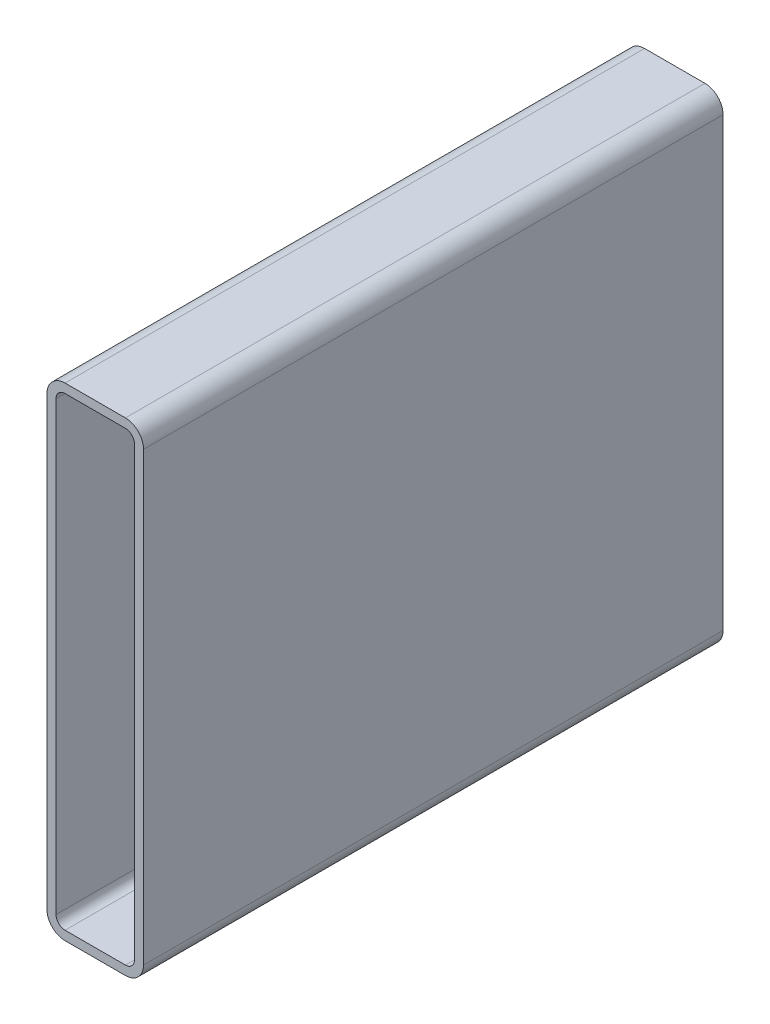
SolidWorks part; units mm, degrees
ref_plane "Front Plane" through (0, 0, 0) normal (0, 0, 1) x (1, 0, 0)
ref_plane "Top Plane" through (0, 0, 0) normal (0, 1, 0) x (1, 0, 0)
ref_plane "Right Plane" through (0, 0, 0) normal (1, 0, 0) x (0, 0, -1)
sketch "Sketch1" plane through (0, 0, 0) normal (0, 0, 1) x (1, 0, 0)
  line B0 (9.525, 254) -> (41.275, 254)
  arc B1 (50.8, 244.475) -> (41.275, 254) centre (41.275, 244.475) ccw
  line B2 (50.8, 244.475) -> (50.8, 9.525)
  arc B3 (41.275, 0) -> (50.8, 9.525) centre (41.275, 9.525) ccw
  line B4 (41.275, 0) -> (9.525, 0)
  arc B5 (0, 9.525) -> (9.525, 0) centre (9.525, 9.525) ccw
  line B6 (0, 9.525) -> (0, 244.475)
  arc B7 (9.525, 254) -> (0, 244.475) centre (9.525, 244.475) ccw
  line B8 (9.525, 249.2375) -> (41.275, 249.2375)
  arc B9 (46.0375, 244.475) -> (41.275, 249.2375) centre (41.275, 244.475) ccw
  line B10 (46.0375, 244.475) -> (46.0375, 9.525)
  arc B11 (41.275, 4.7625) -> (46.0375, 9.525) centre (41.275, 9.525) ccw
  line B12 (41.275, 4.7625) -> (9.525, 4.7625)
  arc B13 (4.7625, 9.525) -> (9.525, 4.7625) centre (9.525, 9.525) ccw
  line B14 (4.7625, 9.525) -> (4.7625, 244.475)
  arc B15 (9.525, 249.2375) -> (4.7625, 244.475) centre (9.525, 244.475) ccw
sketch_block_instance "HSS10x2x0.1875-1"
sketch_block "HSS10x2x0.1875"
extrude "Boss-Extrude1" add sketch "Sketch1" along normal blind 304.8
